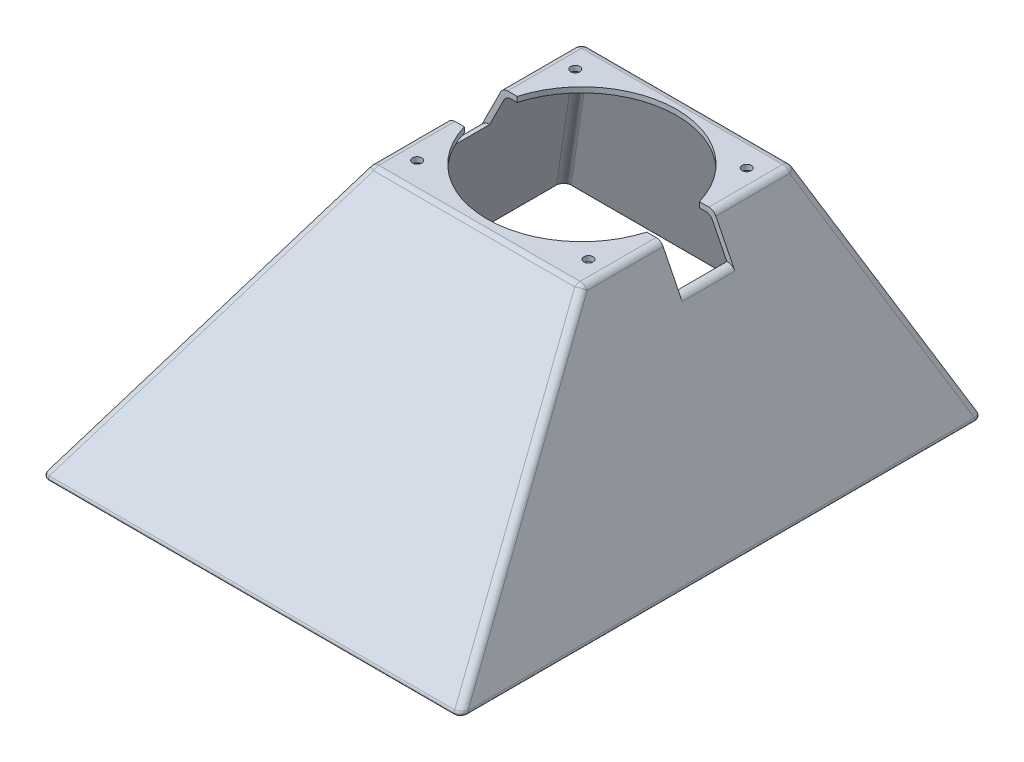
SolidWorks part; units mm, degrees
ref_plane "前视基准面" through (0, 0, 0) normal (0, 0, 1) x (1, 0, 0)
ref_plane "上视基准面" through (0, 0, 0) normal (0, 1, 0) x (1, 0, 0)
ref_plane "右视基准面" through (0, 0, 0) normal (1, 0, 0) x (0, 0, -1)
sketch "草图1" plane through (0, 0, 0) normal (0, 1, 0) x (1, 0, 0)
  line L1 (-80, 73) -> (80, 73)
  line L2 (-80, 73) -> (-80, -127)
  line L3 (-80, -127) -> (80, -127)
  line L4 (80, 73) -> (80, -127)
  line L5 (-80, 73) -> (80, -127) construction
  line L6 (-80, -127) -> (80, 73) construction
  point P0 (0, -27)
  dimension "D1" = 160
  dimension "D2" = 200
  dimension "D3" = 27
ref_plane "基准面1" through (0, 80, 0) normal (0, 1, 0) x (1, 0, 0)
sketch "草图2" plane through (0, 80, 0) normal (0, 1, 0) x (1, 0, 0)
  line L1 (-40, 40) -> (40, 40)
  line L2 (-40, 40) -> (-40, -40)
  line L3 (-40, -40) -> (40, -40)
  line L4 (40, 40) -> (40, -40)
  line L5 (-40, 40) -> (40, -40) construction
  line L6 (-40, -40) -> (40, 40) construction
  point P0 (0, 0)
  dimension "D1" = 80
  dimension "D2" = 80
loft "放样1" add profiles "草图2", "草图1"
shell "抽壳1" thickness 2
sketch "草图3" plane through (0, 78, 0) normal (0, -1, 0) x (1, 0, 0)
  circle A0 centre (0, 0) radius 36
  dimension "D1" = 72
extrude "切除-拉伸1" cut sketch "草图3" against normal blind 10
sketch "草图4" plane through (0, 80, 0) normal (0, 1, 0) x (1, 0, 0)
  line L1 (-45, 10) -> (45, 10)
  line L2 (-45, 10) -> (-45, -10)
  line L3 (-45, -10) -> (45, -10)
  line L4 (45, 10) -> (45, -10)
  line L5 (-45, 10) -> (45, -10) construction
  line L6 (-45, -10) -> (45, 10) construction
  point P0 (0, 0)
  dimension "D1" = 20
  dimension "D2" = 90
extrude "切除-拉伸2" cut sketch "草图4" against normal through all
sketch "草图5" plane through (0, 80, 0) normal (0, 1, 0) x (1, 0, 0)
  line L0 (-103.3063, 0) -> (88.288, 0) construction
  line L1 (0, -72.7442) -> (0, 87.8377) construction
  circle A0 centre (-32.5, 30) radius 1.75
  circle A1 centre (-32.5, -30) radius 1.75
  circle A2 centre (32.5, 30) radius 1.75
  circle A3 centre (32.5, -30) radius 1.75
  dimension "D1" = 60
  dimension "D2" = 65
  dimension "D3" = 3.5
extrude "切除-拉伸3" cut sketch "草图5" against normal blind 10
fillet "圆角1" radius 3 8 edges at (58.2639, 39, -54.749) (58.2639, 39, 81.6327) (-58.2639, 39, 81.6327) (-58.2639, 39, -54.749)
fillet "圆角2" radius 3 10 edges at (-38.7639, 78, -22.9849) (-37.9758, 78, -37.899) (0, 78, -38.6615) (37.9758, 78, -37.899) (-38.7639, 78, 23.1236) (-38.1442, 78, 38.4013) (0, 78, 39.2202) (38.1442, 78, 38.4013) (38.7639, 78, -22.9849) (38.7639, 78, 23.1236)
fillet "圆角3" radius 1 16 edges at (76.9758, 0, -70.074) (77.7639, 0, 26.4637) (77.1442, 0, 123.2263) (0, 0, 124.0452) (-77.1442, 0, 123.2263) (-77.7639, 0, 26.4637) (-76.9758, 0, -70.074) (0, 0, -70.8365)
fillet "圆角4" radius 3 10 edges
fillet "圆角5" radius 3 2 edges at (-45, 70, 0) (45, 70, 0)
